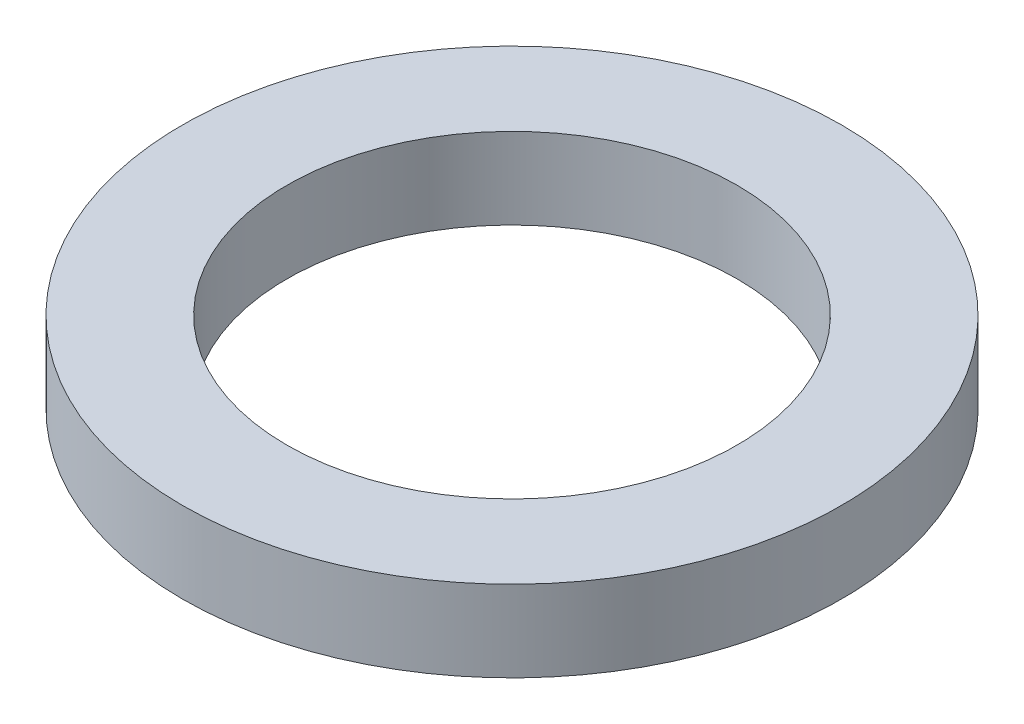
SolidWorks part; units mm, degrees
ref_plane "前基準面" through (0, 0, 0) normal (0, 0, 1) x (1, 0, 0)
ref_plane "上基準面" through (0, 0, 0) normal (0, 1, 0) x (1, 0, 0)
ref_plane "右基準面" through (0, 0, 0) normal (1, 0, 0) x (0, 0, -1)
sketch "草圖2" plane through (0, 0, 0) normal (1, 0, 0) x (0, 0, -1)
  line L0 (0, 2.0064) -> (0, -2.0064) construction
  line L1 (16.25, -4) -> (13.675, -1.8393)
  line L2 (11.1, 0) -> (16.25, 0)
  line L3 (11.1, 0) -> (11.1, -4)
  line L5 (16.25, 0) -> (16.25, -4)
  line L6 (13.675, -1.8393) -> (11.1, -4)
  dimension "D1" = 22.2
  dimension "D2" = 32.5
  dimension "D3" = 100
  dimension "D4" = 4
revolve "旋轉1" add sketch "草圖2" angle 360 about L0
